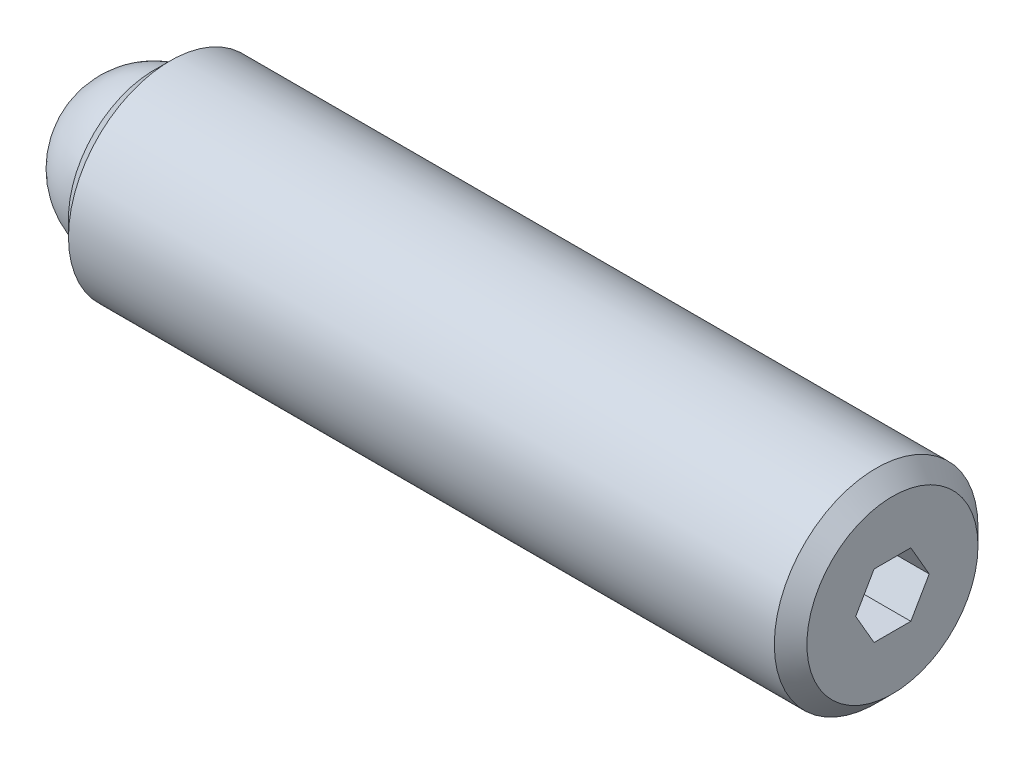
SolidWorks part; units mm, degrees
ref_plane "Front Plane" through (0, 0, 0) normal (0, 0, 1) x (1, 0, 0)
ref_plane "Top Plane" through (0, 0, 0) normal (0, 1, 0) x (1, 0, 0)
ref_plane "Right Plane" through (0, 0, 0) normal (1, 0, 0) x (0, 0, -1)
sketch "Sketch2" plane through (0, 0, 0) normal (1, 0, 0) x (0, 0, -1)
  circle A0 centre (0, 0) radius 3.175
  dimension "D1" = 6.35
extrude "Boss-Extrude1" add sketch "Sketch2" along normal blind 23.0188
sketch "Sketch3" plane through (0, 0, 0) normal (-1, 0, 0) x (0, 0, 1)
  circle A0 centre (0, 0) radius 2.3813
  dimension "D1" = 4.7625
chamfer "Chamfer1" distance 0.508 angle 45 1 edges at (0, 0, -3.175)
chamfer "Chamfer2" distance 0.508 angle 45 1 edges at (23.0188, 0, -3.175)
sketch "Sketch4" plane through (23.0188, 0, 0) normal (1, 0, 0) x (0, 0, -1)
  line L1 (1.1457, 0) -> (0.5728, 0.9922)
  line L2 (0.5728, 0.9922) -> (-0.5728, 0.9922)
  line L3 (-0.5728, 0.9922) -> (-1.1457, 0)
  line L4 (-1.1457, 0) -> (-0.5728, -0.9922)
  line L5 (-0.5728, -0.9922) -> (0.5728, -0.9922)
  line L6 (0.5728, -0.9922) -> (1.1457, 0)
  circle A0 centre (0, 0) radius 0.9922 construction
  dimension "D1" = 1.9844
extrude "Cut-Extrude2" cut sketch "Sketch4" against normal blind 2.286
extrude "Cut-Extrude3" cut sketch "Sketch3" against normal blind 1.9844
sketch "Sketch5" plane through (0, 0, 0) normal (-1, 0, 0) x (0, 0, 1)
  line L0 (0, 0) -> (0, -2.3813)
  line L1 (0, 0) -> (0, 2.3813)
  arc A0 (0, 2.3813) -> (0, -2.3813) centre (0, 0) ccw
  dimension "D1" = 2.3813
revolve "Revolve1" add sketch "Sketch5" angle 360 about L1
